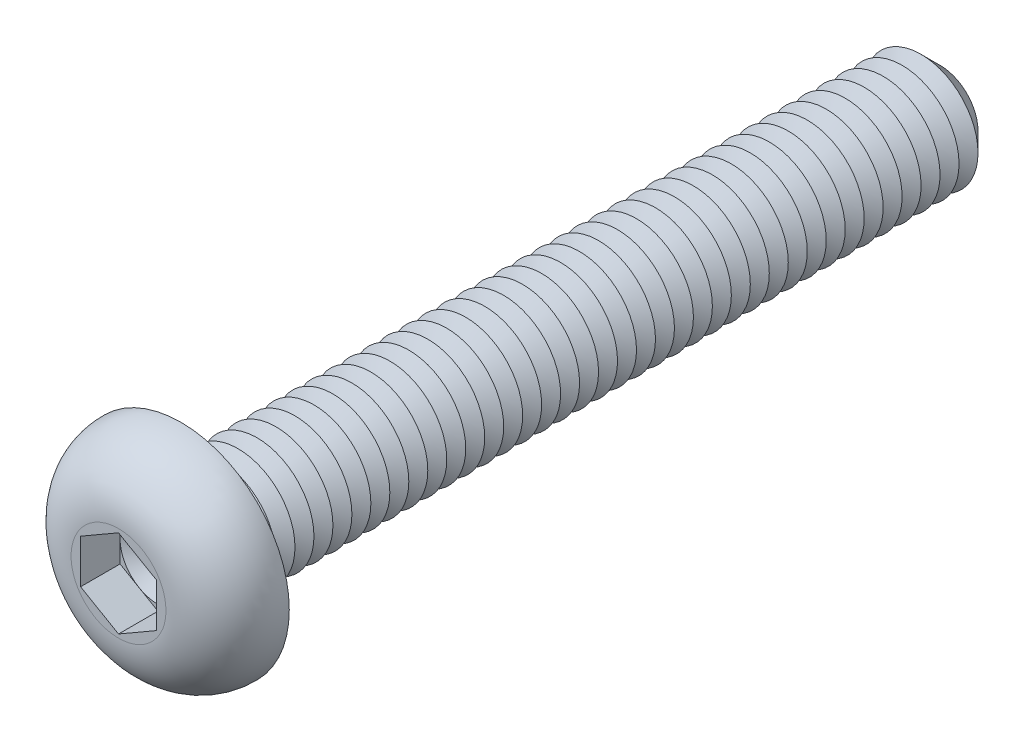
SolidWorks part; units mm, degrees
ref_plane "Front Plane" through (0, 0, 0) normal (0, 0, 1) x (1, 0, 0)
ref_plane "Top Plane" through (0, 0, 0) normal (0, 1, 0) x (1, 0, 0)
ref_plane "Right Plane" through (0, 0, 0) normal (1, 0, 0) x (0, 0, -1)
sketch "Sketch1" plane through (0, 0, 0) normal (1, 0, 0) x (0, 0, -1)
  line L0 (-47.9342, 0) -> (60.3146, 0) construction
sketch "Sketch2" plane through (0, 0, 0) normal (1, 0, 0) x (0, 0, -1)
  line L0 (0, 0) -> (-1.65, 0)
  line L1 (-47.9342, 0) -> (60.3146, 0) construction
  line L2 (-1.65, 0) -> (-1.65, 1.2508)
  line L3 (0, 2.85) -> (0, 0)
  arc A0 (-1.65, 1.2508) -> (0, 2.85) centre (-0.05, 1.2508) cw
  dimension "D1" = 1.6
  dimension "D2" = 1.65
  dimension "D3" = 2.85
revolve "Revolve1" add sketch "Sketch2" angle 360 about L0
sketch "Sketch3" plane through (0, 0, 1.65) normal (0, 0, 1) x (1, 0, 0)
  line L1 (0, 1.1547) -> (-1, 0.5774)
  line L2 (-1, 0.5774) -> (-1, -0.5774)
  line L3 (-1, -0.5774) -> (0, -1.1547)
  line L4 (0, -1.1547) -> (1, -0.5774)
  line L5 (1, -0.5774) -> (1, 0.5774)
  line L6 (1, 0.5774) -> (0, 1.1547)
  circle A0 centre (0, 0) radius 1 construction
  dimension "D1" = 2
extrude "Cut-Extrude1" cut sketch "Sketch3" against normal blind 1.04
sketch "Sketch4" plane through (0, 0, 0) normal (0, 0, -1) x (-1, 0, 0)
  circle A0 centre (0, 0) radius 1.5
  dimension "D1" = 3
extrude "Boss-Extrude1" add sketch "Sketch4" along normal blind 20
chamfer "Chamfer1" distance 0.5 angle 45 1 edges at (-1.5, 0, -20)
sketch "Sketch5" plane through (0, 0, 0) normal (1, 0, 0) x (0, 0, -1)
  line L0 (0.5, 1.5) -> (1, 1.5)
  line L1 (19.5, 1.5) -> (0, 1.5) construction
  line L2 (1, 1.5) -> (0.75, 1.067)
  line L3 (0.75, 1.067) -> (0.5, 1.5)
  line L4 (0, -2.85) -> (0, 2.85) construction
  line L5 (19.5, 1.5) -> (0, 1.5) construction
  dimension "D1" = 0.5
  dimension "D2" = 0.5
revolve "Cut-Revolve1" cut sketch "Sketch5" angle 360 about L0
pattern_linear "LPattern1" count 38 spacing 0.5 along (0, 0, -1) of "Cut-Revolve1"
fillet "Fillet2" radius 0.2 1 edges at (1.5, 0, 0)
sketch "Sketch6" plane through (0, 0, 0.61) normal (0, 0, 1) x (1, 0, 0)
  line L0 (0, -1.1547) -> (1, -0.5774) construction
  circle A0 centre (0, 0) radius 1
extrude "Cut-Extrude2" cut sketch "Sketch6" against normal through all draft 60
